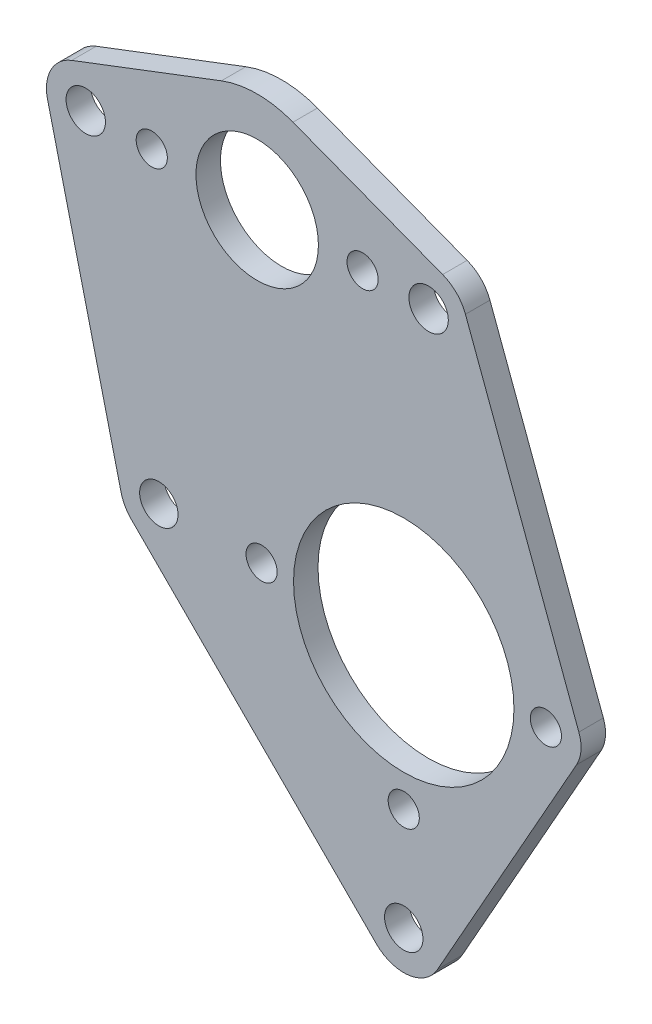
SolidWorks part; units mm, degrees
ref_plane "Front Plane" through (0, 0, 0) normal (0, 0, 1) x (1, 0, 0)
ref_plane "Top Plane" through (0, 0, 0) normal (0, 1, 0) x (1, 0, 0)
ref_plane "Right Plane" through (0, 0, 0) normal (1, 0, 0) x (0, 0, -1)
sketch "Sketch1" plane through (0, 0, 0) normal (0, 0, 1) x (1, 0, 0)
  line L0 (-18.4277, 0) -> (18.4277, 0) construction
  line L1 (0, 0) -> (0, -18.4277) construction
  line L2 (-18.4277, 0) -> (-31.75, 0) construction
  line L3 (0, -18.4277) -> (0, -31.75) construction
  line L4 (-36.6378, -1.1843) -> (-46.1737, 38.1707)
  line L5 (-43.0401, 44.1279) -> (-23.6409, 51.5318)
  line L6 (-14.3575, 51.5318) -> (5.0417, 44.1279)
  line L7 (-3.5562, -35.3062) -> (-35.3062, -3.5562)
  line L8 (-18.9992, 39.37) -> (-5.334, 39.37) construction
  line L9 (-5.334, 39.37) -> (3.2258, 39.37) construction
  line L10 (-18.9992, 39.37) -> (-32.6644, 39.37) construction
  line L11 (-32.6644, 39.37) -> (-41.2242, 39.37) construction
  line L12 (4.3816, -34.2187) -> (22.3999, -2.238)
  line L13 (7.9994, 41.1442) -> (22.7014, 1.5884)
  circle A0 centre (0, 0) radius 14.2875
  circle A1 centre (18.4277, 0) radius 2.0193
  circle A2 centre (-18.4277, 0) radius 2.0193
  circle A3 centre (0, -18.4277) radius 2.0193
  circle A4 centre (-31.75, 0) radius 2.4892
  circle A5 centre (0, -31.75) radius 2.4892
  circle A6 centre (0, 0) radius 19.3675 construction
  circle A7 centre (-31.75, 0) radius 5.0292 construction
  circle A8 centre (0, -31.75) radius 5.0292 construction
  circle A9 centre (18.4277, 0) radius 4.5593 construction
  arc A10 (-36.6378, -1.1843) -> (-35.3062, -3.5562) centre (-31.75, 0) ccw
  arc A11 (-3.5562, -35.3062) -> (4.3816, -34.2187) centre (0, -31.75) ccw
  circle A12 centre (-18.9992, 39.37) radius 13.0175 construction
  circle A13 centre (-41.2242, 39.37) radius 5.0927 construction
  circle A14 centre (-18.9992, 39.37) radius 7.9375
  circle A15 centre (-18.9992, 39.37) radius 11.1125 construction
  circle A16 centre (-5.334, 39.37) radius 2.5527 construction
  circle A17 centre (-32.6644, 39.37) radius 2.5527 construction
  circle A18 centre (-41.2242, 39.37) radius 2.5527
  circle A19 centre (3.2258, 39.37) radius 2.5527
  circle A20 centre (-5.334, 39.37) radius 2.0193
  circle A21 centre (-32.6644, 39.37) radius 2.0193
  circle A22 centre (3.2258, 39.37) radius 5.0927 construction
  arc A23 (22.4812, -2.0872) -> (22.3999, -2.238) centre (18.4277, 0) cw
  arc A24 (7.9994, 41.1442) -> (5.0417, 44.1279) centre (3.2258, 39.37) ccw
  arc A25 (-14.3575, 51.5318) -> (-23.6409, 51.5318) centre (-18.9992, 39.37) ccw
  arc A26 (-43.0401, 44.1279) -> (-46.1737, 38.1707) centre (-41.2242, 39.37) ccw
  arc A27 (22.7014, 1.5884) -> (22.4812, -2.0872) centre (18.4277, 0) cw
  dimension "D3" = 28.575
  dimension "D4" = 4.0386
  dimension "D5" = 4.9784
  dimension "D7" = 5.08
  dimension "D11" = 15.875
  dimension "D12" = 22.225
  dimension "D13" = 5.1054
  dimension "D14" = 4.0386
  dimension "D16" = 5.1054
  dimension "D1" = 18.4277
  dimension "D2" = 18.4277
  dimension "D6" = 31.75
  dimension "D15" = 22.225
  dimension "D17" = 39.37
  dimension "D20" = 3.2258
  dimension "D8" = 2.54
  dimension "D9" = 2.54
  dimension "D10" = 2.54
  dimension "D18" = 5.08
  dimension "D19" = 2.54
extrude "Boss-Extrude1" add sketch "Sketch1" along normal blind 3.175
